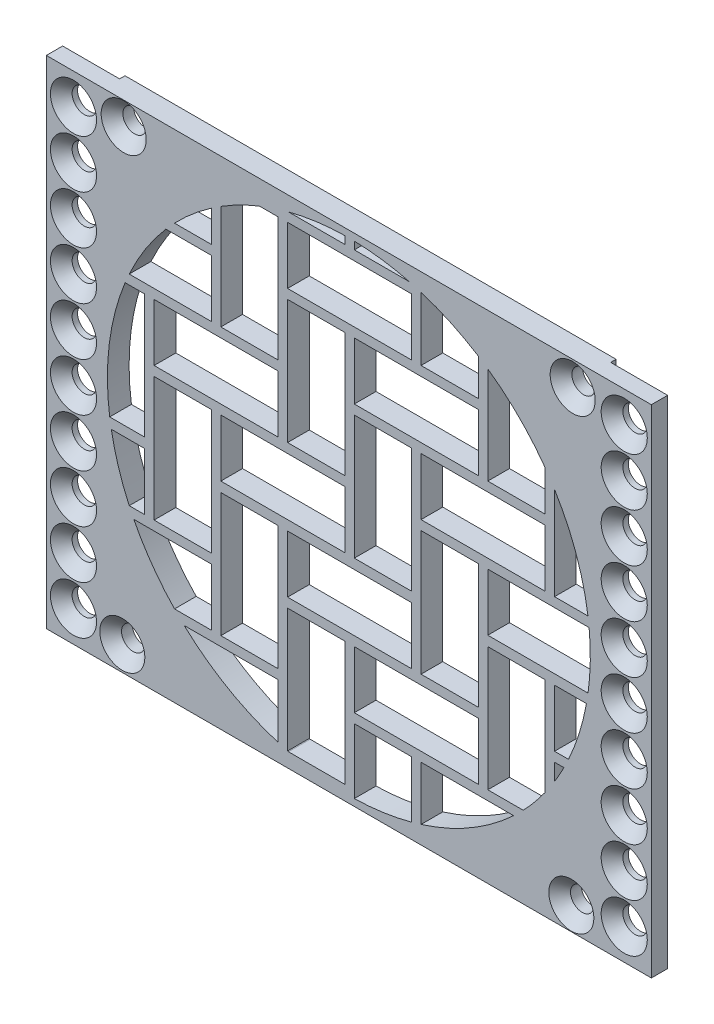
SolidWorks part; units mm, degrees
ref_plane "Front Plane" through (0, 0, 0) normal (0, 0, 1) x (1, 0, 0)
ref_plane "Top Plane" through (0, 0, 0) normal (0, 1, 0) x (1, 0, 0)
ref_plane "Right Plane" through (0, 0, 0) normal (1, 0, 0) x (0, 0, -1)
sketch "Sketch1" plane through (0, 0, 0) normal (0, 0, 1) x (1, 0, 0)
  line L0 (-1.8311, 0) -> (39.4189, 41.25) construction
  line L1 (-1.8311, 45.75) -> (-1.8311, 0) construction
  line L2 (-57.5811, -45.75) -> (53.9189, -45.75)
  line L4 (53.9189, 45.75) -> (-57.5811, 45.75)
  line L6 (53.9189, -45.75) -> (53.9189, 45.75)
  line L8 (-57.5811, 41.5) -> (-52.5811, 41.5) construction
  line L9 (-47.5811, 0) -> (-39.6799, 0) construction
  line L13 (-57.5811, -45.75) -> (-57.5811, 45.75)
  line L14 (-57.5811, 41.5) -> (-64.546, 41.5) construction
  line L15 (-47.5811, 0) -> (-52.5811, 0) construction
  line L16 (-52.5811, 4.45) -> (-52.5811, -4.45) construction
  circle A0 centre (39.4189, 41.25) radius 2.15
  circle A1 centre (39.1689, -41.5) radius 2.15
  circle A2 centre (-43.5811, -41.25) radius 2.15
  circle A3 centre (-43.3311, 41.5) radius 2.15
  circle A4 centre (-1.8311, 0) radius 44.5
  circle A12 centre (-52.5811, -40.05) radius 2.25
  circle A13 centre (-52.5811, -31.15) radius 2.25
  circle A14 centre (-52.5811, -22.25) radius 2.25
  circle A15 centre (-52.5811, -13.35) radius 2.25
  circle A16 centre (-52.5811, -4.45) radius 2.25
  circle A17 centre (-52.5811, 4.45) radius 2.25
  circle A18 centre (-52.5811, 13.35) radius 2.25
  circle A19 centre (-52.5811, 22.25) radius 2.25
  circle A20 centre (-52.5811, 31.15) radius 2.25
  circle A21 centre (-52.5811, 40.05) radius 2.25
  circle A22 centre (48.9189, 40.05) radius 2.25
  circle A23 centre (48.9189, 31.15) radius 2.25
  circle A24 centre (48.9189, 22.25) radius 2.25
  circle A25 centre (48.9189, 13.35) radius 2.25
  circle A26 centre (48.9189, 4.45) radius 2.25
  circle A27 centre (48.9189, -4.45) radius 2.25
  circle A28 centre (48.9189, -13.35) radius 2.25
  circle A29 centre (48.9189, -22.25) radius 2.25
  circle A30 centre (48.9189, -31.15) radius 2.25
  circle A31 centre (48.9189, -40.05) radius 2.25
  point P6 (-1.8311, 0)
  point P18 (-2.0811, 0)
  dimension "D1" = 89
sketch "Sketch2" plane through (0, 0, 0) normal (0, 0, 1) x (1, 0, 0)
  line L4 (36.0704, -7.9334) -> (41.956, -7.9334)
  line L6 (38.648, -18.4849) -> (36.0704, -18.4849)
  line L7 (36.0704, -18.4849) -> (36.0704, -7.9334)
  line L20 (-25.4283, -7.9334) -> (-25.4281, -30.7847)
  line L22 (-27.1766, -18.485) -> (-37.7279, -18.485)
  line L27 (42.2369, 6.1851) -> (36.0704, 6.1851)
  line L28 (36.0704, 6.1851) -> (36.0704, 23.3179)
  line L31 (23.7707, 4.4368) -> (42.4471, 4.4368)
  line L33 (42.2468, -6.1144) -> (23.7707, -6.1144)
  line L34 (23.7707, -6.1144) -> (23.7707, 4.4368)
  line L36 (36.0704, -23.3179) -> (36.0704, -20.2333)
  line L37 (36.0704, -20.2333) -> (37.803, -20.2333)
  line L39 (-27.1766, -18.485) -> (-27.1766, 4.4368)
  line L48 (-27.1766, 4.4368) -> (-37.7279, 4.4368)
  line L53 (-27.1766, -30.7847) -> (-33.9645, -30.7847)
  line L55 (-41.4653, -20.2333) -> (-27.1766, -20.2333)
  line L56 (-27.1766, -20.2333) -> (-27.1766, -30.7847)
  line L57 (-39.4762, -18.485) -> (-42.3102, -18.485)
  line L59 (-45.6182, -7.9335) -> (-39.4762, -7.9335)
  line L60 (-39.4762, -7.9335) -> (-39.4762, -18.485)
  line L61 (-39.4762, -6.1144) -> (-45.9091, -6.1144)
  line L63 (-43.0639, 16.7366) -> (-39.4762, 16.7366)
  line L64 (-39.4762, 16.7366) -> (-39.4762, -6.1144)
  line L65 (-27.1765, 18.4849) -> (-42.3103, 18.4849)
  line L67 (-35.5527, 29.0364) -> (-27.1765, 29.0364)
  line L68 (-27.1765, 29.0364) -> (-27.1765, 18.4849)
  line L73 (-37.7279, -18.485) -> (-37.7279, 4.4368)
  line L78 (-2.5771, 43.0844) -> (-12.9658, 43.0844)
  line L81 (-2.5771, 44.4937) -> (-2.5771, 43.0844)
  line L82 (9.7226, 30.7847) -> (-13.1284, 30.7847)
  line L83 (-13.1284, 30.7847) -> (-13.1284, 41.3361)
  line L84 (-13.1284, 41.3361) -> (9.7226, 41.3361)
  line L85 (9.7226, 41.3361) -> (9.7226, 30.7847)
  line L86 (9.3035, 43.0844) -> (-0.8287, 43.0844)
  line L87 (-0.8287, 43.0844) -> (-0.8287, 44.4887)
  line L96 (34.322, 25.9461) -> (34.322, 18.4849)
  line L97 (34.322, 18.4849) -> (23.7707, 18.4849)
  line L98 (23.7707, 18.4849) -> (23.7707, 36.3978)
  line L99 (11.471, 16.7366) -> (34.322, 16.7366)
  line L100 (34.322, 16.7366) -> (34.322, 6.1851)
  line L101 (34.322, 6.1851) -> (11.471, 6.1851)
  line L102 (11.471, 6.1851) -> (11.471, 16.7366)
  line L103 (23.7707, -30.7847) -> (23.7707, -7.9334)
  line L104 (23.7707, -7.9334) -> (30.9959, -7.9334)
  line L105 (30.9959, -7.9334) -> (34.322, -7.9334)
  line L106 (34.322, -7.9334) -> (34.322, -25.946)
  line L107 (30.3022, -30.7847) -> (23.7707, -30.7847)
  line L108 (11.471, -32.5331) -> (28.5308, -32.5331)
  line L111 (11.471, -42.4653) -> (11.471, -32.5331)
  line L116 (-0.8287, -20.2332) -> (22.0223, -20.2332)
  line L117 (22.0223, -20.2332) -> (22.0223, -30.7847)
  line L118 (22.0223, -30.7847) -> (-0.8287, -30.7847)
  line L119 (-0.8287, -30.7847) -> (-0.8287, -20.2332)
  line L120 (-0.8287, -32.5331) -> (9.7226, -32.5331)
  line L121 (9.7226, -32.5331) -> (9.7226, -42.974)
  line L123 (-0.8287, -44.4887) -> (-0.8287, -32.5331)
  line L124 (9.7226, -6.1144) -> (-0.8287, -6.1144)
  line L125 (-0.8287, -6.1144) -> (-0.8287, 16.7366)
  line L126 (-0.8287, 16.7366) -> (9.7226, 16.7366)
  line L127 (9.7226, 16.7366) -> (9.7226, -6.1144)
  line L128 (11.471, 4.4368) -> (22.0224, 4.4368)
  line L129 (22.0224, 4.4368) -> (22.0224, -6.9886)
  line L130 (22.0224, -6.9886) -> (22.0224, -18.485)
  line L131 (22.0224, -18.485) -> (11.471, -18.485)
  line L132 (11.471, -18.485) -> (11.471, -6.9886)
  line L133 (11.471, -6.9886) -> (11.471, 4.4368)
  line L135 (22.0223, 37.5668) -> (22.0223, 30.7847)
  line L136 (22.0223, 30.7847) -> (11.471, 30.7847)
  line L137 (11.471, 30.7847) -> (11.471, 42.4653)
  line L138 (22.0224, 18.4849) -> (-0.8287, 18.4849)
  line L139 (-0.8287, 18.4849) -> (-0.8287, 29.0364)
  line L140 (-0.8287, 29.0364) -> (22.0224, 29.0364)
  line L141 (22.0224, 29.0364) -> (22.0224, 18.4849)
  line L142 (-13.1285, -7.9334) -> (9.7226, -7.9334)
  line L143 (9.7226, -7.9334) -> (9.7226, -18.4849)
  line L144 (9.7226, -18.4849) -> (-13.1285, -18.4849)
  line L145 (-13.1285, -18.4849) -> (-13.1285, -7.9334)
  line L146 (-13.1285, -20.2332) -> (-2.5771, -20.2332)
  line L147 (-2.5771, -20.2332) -> (-2.5771, -43.0842)
  line L148 (-2.5771, -43.0842) -> (-12.9666, -43.0842)
  line L149 (-13.1285, -43.0421) -> (-13.1285, -20.2332)
  line L150 (-13.1285, 29.0364) -> (-2.5771, 29.0364)
  line L151 (-2.5771, 29.0364) -> (-2.5771, 6.1851)
  line L152 (-2.5771, 6.1851) -> (-13.1285, 6.1851)
  line L153 (-13.1285, 6.1851) -> (-13.1285, 29.0364)
  line L154 (-25.4281, 4.4368) -> (-2.5771, 4.4368)
  line L155 (-2.5771, 4.4368) -> (-2.5771, -6.1144)
  line L156 (-2.5771, -6.1144) -> (-25.4281, -6.1144)
  line L157 (-25.4281, -6.1144) -> (-25.4281, 4.4368)
  line L162 (-25.4283, -7.9334) -> (-14.8768, -7.9334)
  line L163 (-14.8768, -7.9334) -> (-14.8768, -30.7847)
  line L164 (-14.8768, -30.7847) -> (-25.4281, -30.7847)
  line L172 (-18.3107, 41.3361) -> (-14.8768, 41.3361)
  line L173 (-14.8768, 41.3361) -> (-14.8768, 18.4849)
  line L174 (-14.8768, 18.4849) -> (-25.4281, 18.4849)
  line L175 (-25.4281, 18.4849) -> (-25.4281, 37.7284)
  line L176 (-27.1765, 30.7847) -> (-33.9645, 30.7847)
  line L179 (-27.1765, 36.5768) -> (-27.1765, 30.7847)
  line L180 (-14.8768, 6.1851) -> (-37.7279, 6.1851)
  line L181 (-37.7279, 6.1851) -> (-37.7279, 16.7366)
  line L182 (-37.7279, 16.7366) -> (-14.8768, 16.7366)
  line L183 (-14.8768, 16.7366) -> (-14.8768, 6.1851)
  line L188 (-32.1931, -32.5331) -> (-14.8768, -32.5331)
  line L189 (-14.8768, -32.5331) -> (-14.8768, -42.5448)
  circle A0 centre (-1.8311, 0) radius 44.5 construction
  arc A1 (-14.8768, -42.5448) -> (-13.1285, -43.0421) centre (-1.8311, 0) ccw
  arc A2 (-33.9645, -30.7847) -> (-32.1931, -32.5331) centre (-1.8311, 0) ccw
  arc A3 (-42.3102, -18.485) -> (-41.4653, -20.2333) centre (-1.8311, 0) ccw
  arc A4 (-45.9091, -6.1144) -> (-45.6182, -7.9335) centre (-1.8311, 0) ccw
  arc A5 (-42.3103, 18.4849) -> (-43.0639, 16.7366) centre (-1.8311, 0) ccw
  arc A6 (-33.9645, 30.7847) -> (-35.5527, 29.0364) centre (-1.8311, 0) ccw
  arc A7 (9.7226, -42.974) -> (11.471, -42.4653) centre (-1.8311, 0) ccw
  arc A8 (28.5308, -32.5331) -> (30.3022, -30.7847) centre (-1.8311, 0) ccw
  arc A9 (34.322, -25.946) -> (36.0704, -23.3179) centre (-1.8311, 0) ccw
  arc A10 (41.956, -7.9334) -> (42.2468, -6.1144) centre (-1.8311, 0) ccw
  arc A11 (42.4471, 4.4368) -> (42.2369, 6.1851) centre (-1.8311, 0) ccw
  arc A12 (36.0704, 23.3179) -> (34.322, 25.9461) centre (-1.8311, 0) ccw
  arc A13 (23.7707, 36.3978) -> (22.0223, 37.5668) centre (-1.8311, 0) ccw
  arc A14 (11.471, 42.4653) -> (9.3035, 43.0844) centre (-1.8311, 0) ccw
  arc A15 (-0.8287, 44.4887) -> (-2.5771, 44.4937) centre (-1.8311, 0) ccw
  arc A16 (-12.9658, 43.0844) -> (-18.3107, 41.3361) centre (-1.8311, 0) ccw
  arc A17 (-25.4281, 37.7284) -> (-27.1765, 36.5768) centre (-1.8311, 0) ccw
  arc A18 (-12.9666, -43.0842) -> (-0.8287, -44.4887) centre (-1.8311, 0) ccw
  arc A19 (37.803, -20.2333) -> (38.648, -18.4849) centre (-1.8311, 0) ccw
extrude "Boss-Extrude1" add sketch "Sketch1" along normal blind 4
extrude "Boss-Extrude2" add sketch "Sketch2" along normal blind 4
sketch "Sketch3" plane through (0, 0, 0) normal (0, 0, 1) x (1, 0, 0)
  line L0 (53.9189, 45.75) -> (-57.5811, 45.75) construction
  line L1 (-57.5811, -45.75) -> (-47.0811, -45.75)
  line L2 (-57.5811, -45.75) -> (-57.5811, 45.75)
  line L3 (-57.5811, 45.75) -> (-47.0811, 45.75)
  line L4 (-47.0811, -45.75) -> (-47.0811, 45.75)
  line L6 (53.9189, -45.75) -> (43.4189, -45.75)
  line L7 (53.9189, -45.75) -> (53.9189, 45.75)
  line L8 (53.9189, 45.75) -> (43.4189, 45.75)
  line L9 (43.4189, -45.75) -> (43.4189, 45.75)
  dimension "D1" = 10.5
  dimension "D2" = 10.5
extrude "Cut-Extrude1" cut sketch "Sketch3" along normal blind 1
chamfer "Chamfer1" distance 2 angle 45 24 edges at (41.3189, -41.5, 4) (46.6689, -40.05, 4) (46.6689, -31.15, 4) (46.6689, -22.25, 4) (46.6689, -13.35, 4) (46.6689, -4.45, 4) (46.6689, 4.45, 4) (46.6689, 13.35, 4) (46.6689, 22.25, 4) (46.6689, 31.15, 4) (46.6689, 40.05, 4) (41.5689, 41.25, 4) (-41.1811, 41.5, 4) (-41.4311, -41.25, 4) (-50.3311, -40.05, 4) (-50.3311, -31.15, 4) (-50.3311, -22.25, 4) (-50.3311, -13.35, 4) (-50.3311, -4.45, 4) (-50.3311, 4.45, 4) (-50.3311, 13.35, 4) (-50.3311, 22.25, 4) (-50.3311, 31.15, 4) (-50.3311, 40.05, 4)
